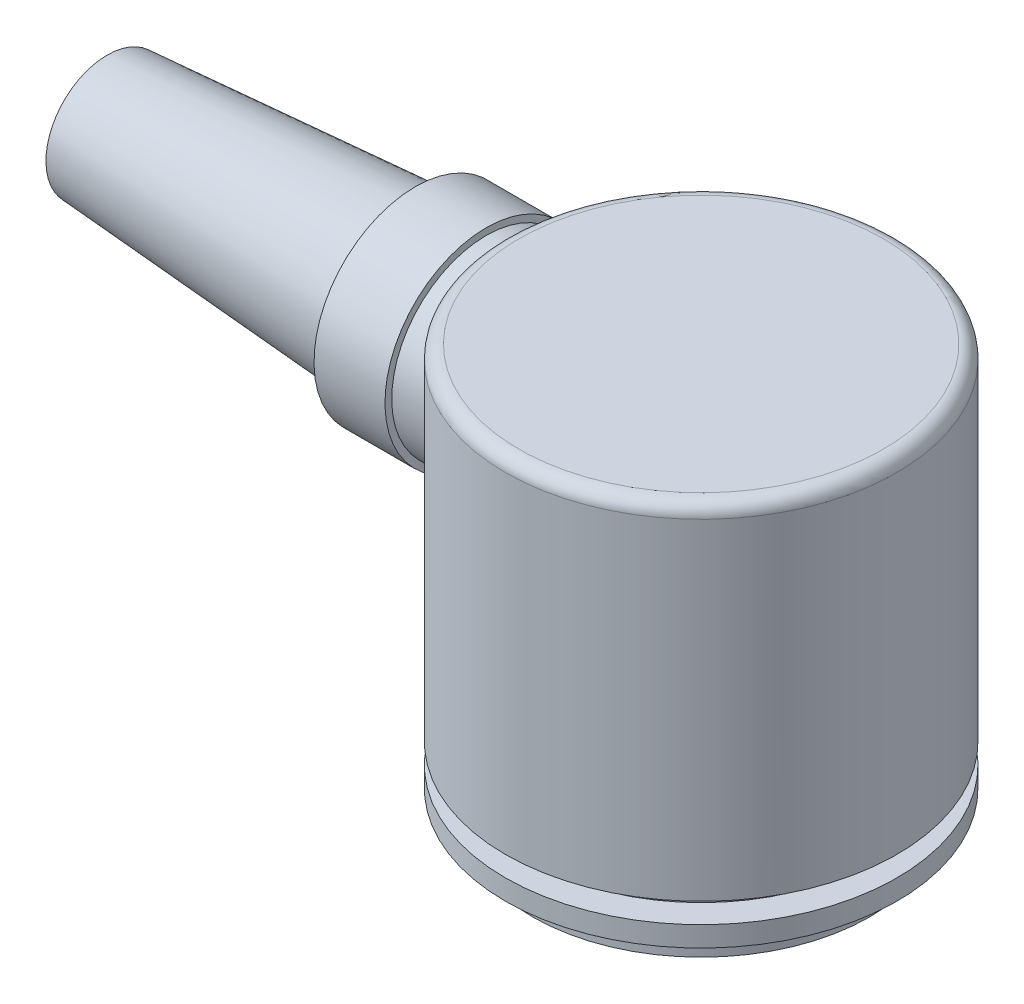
SolidWorks part; units mm, degrees
ref_plane "Plan1" through (0, 0, 0) normal (0, 0, 1) x (1, 0, 0)
ref_plane "Plan2" through (0, 0, 0) normal (0, 1, 0) x (1, 0, 0)
ref_plane "Plan3" through (0, 0, 0) normal (1, 0, 0) x (0, 0, -1)
sketch "Esquisse1" plane through (0, 0, 0) normal (0, 0, 1) x (1, 0, 0)
  line L0 (0, 38.0375) -> (0, -34) construction
  line L1 (3, -10) -> (3, 0)
  line L2 (3, 0) -> (25, 0)
  line L3 (25, 0) -> (25, 4)
  line L4 (25, 4) -> (29, 4)
  line L5 (29, 4) -> (29, 7)
  line L6 (29, 7) -> (25, 7)
  line L7 (25, 7) -> (25, 10)
  line L8 (25, 10) -> (29, 10)
  line L9 (29, 10) -> (29, 61)
  line L10 (29, 61) -> (0, 61)
  line L11 (0, 61) -> (0, -10)
  line L12 (0, -10) -> (3, -10)
  dimension "D1" = 25
  dimension "D2" = 29
  dimension "D3" = 10
  dimension "D4" = 3
  dimension "D5" = 4
  dimension "D6" = 3
  dimension "D7" = 3
  dimension "D8" = 57
revolve "Base-Révolution" add sketch "Esquisse1" angle 360 about L0
fillet "Congé1" radius 2
sketch "Esquisse2" plane through (0, 0, 0) normal (0, 0, 1) x (1, 0, 0)
  line L0 (0, 45) -> (-54.3808, 45) construction
  line L1 (27, 61) -> (-27, 61) construction
  line L2 (0, 59) -> (-31.8435, 59)
  line L3 (-31.8435, 59) -> (-31.8435, 60)
  line L4 (-31.8435, 60) -> (-42.3524, 60)
  line L5 (-42.3524, 60) -> (-42.3524, 57.2551)
  line L6 (-42.3524, 57.2551) -> (-88, 54.0631)
  line L7 (-88, 54.0631) -> (-88, 45)
  line L8 (-88, 45) -> (0, 45)
  line L9 (0, 59) -> (0, 45)
  line L10 (-29, 59) -> (-29, 10) construction
  dimension "D1" = 16
  dimension "D2" = 15
  dimension "D3" = 14
  dimension "D4" = 2.8435
  dimension "D5" = 10.509
  dimension "D6" = 4
  dimension "D7" = 59
  dimension "D8" = 9.0631
revolve "Boss.-Révol.1" add sketch "Esquisse2" angle 360 about L0
hole_wizard "Perçage1" positions "Esquisse5" profile "Esquisse4" legacy
sketch "Esquisse5" plane through (0, 0, 0) normal (0, -1, 0) x (1, 0, 0)
  line L0 (0, 0) -> (21.6795, 0) construction
  line L1 (0, -50) -> (0, 50) construction
  point P0 (21, 0)
  dimension "D1" = 90
  dimension "D2" = 21
sketch "Esquisse4" plane through (21, 0, 0) normal (1, 0, 0) x (0, 0, -1)
  line L0 (0, 0) -> (0, 8.2017)
  line L1 (0, 8.2017) -> (2, 7)
  line L2 (2, 7) -> (2, 0)
  line L4 (2, 0) -> (0, 0)
  line L6 (0, 8.2017) -> (-2, 7) construction
  line L7 (0, -4.2442) -> (0, 117.3081) construction
  dimension "Diamètre" = 4
  dimension "Profondeur" = 7
  dimension "Angle" = 118
pattern_circular "Répétition circulaire1" count 3 every 120
